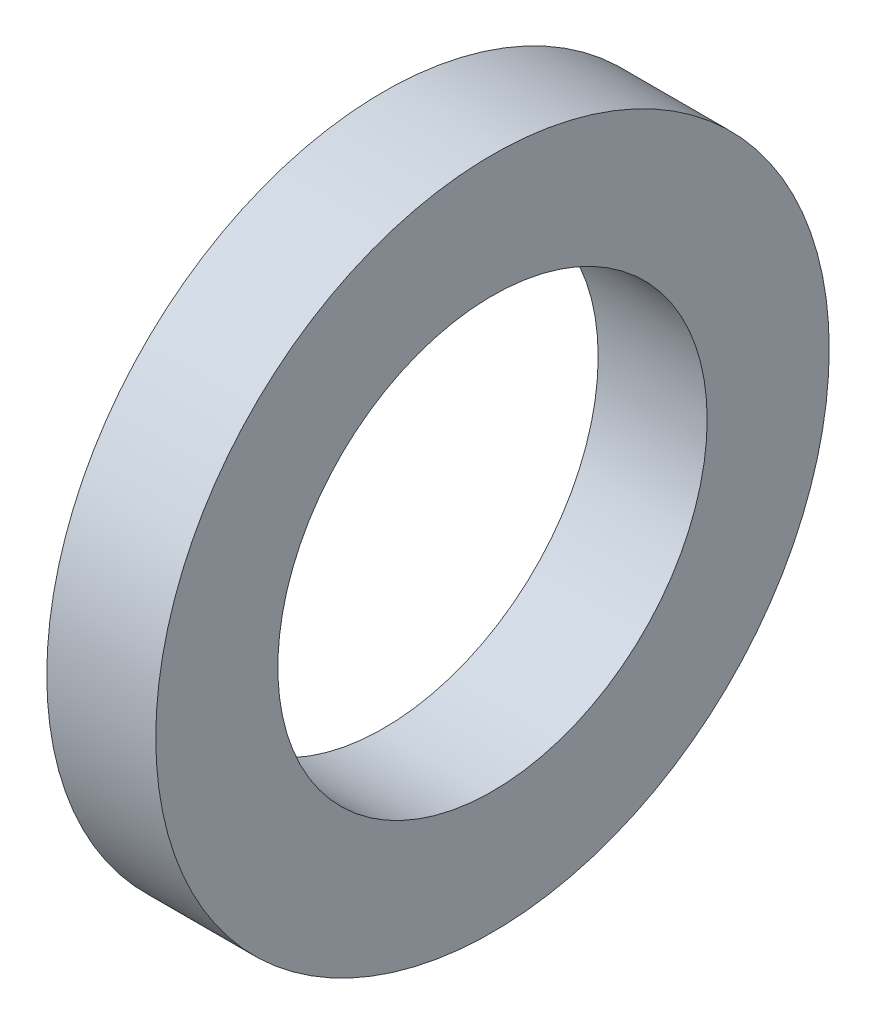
SolidWorks part; units mm, degrees
ref_plane "Front Plane" through (0, 0, 0) normal (0, 0, 1) x (1, 0, 0)
ref_plane "Top Plane" through (0, 0, 0) normal (0, 1, 0) x (1, 0, 0)
ref_plane "Right Plane" through (0, 0, 0) normal (1, 0, 0) x (0, 0, -1)
sketch "Sketch1" plane through (0, 0, 0) normal (1, 0, 0) x (0, 0, -1)
  circle A0 centre (0, 0) radius 19.6215
  circle A1 centre (0, 0) radius 12.5095
extrude "Extrude1" add sketch "Sketch1" along normal blind 6.35
